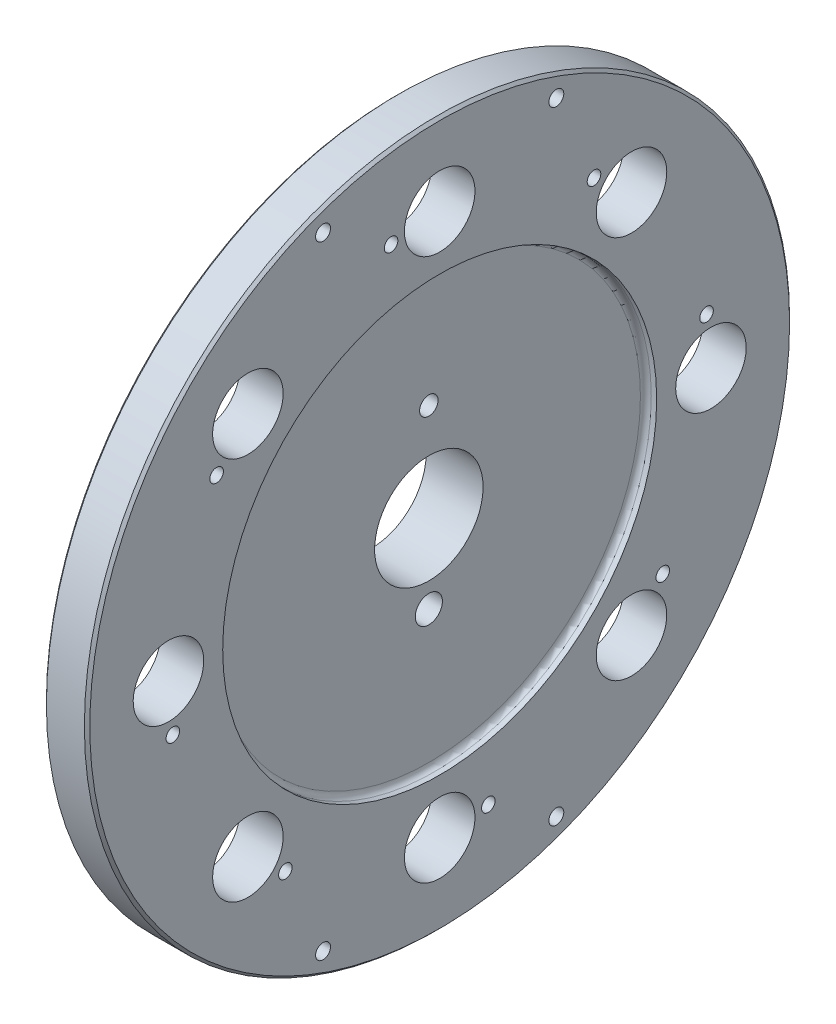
SolidWorks part; units mm, degrees
ref_plane "Płaszczyzna przednia" through (0, 0, 0) normal (0, 0, 1) x (1, 0, 0)
ref_plane "Płaszczyzna górna" through (0, 0, 0) normal (0, 1, 0) x (1, 0, 0)
ref_plane "Płaszczyzna prawa" through (0, 0, 0) normal (1, 0, 0) x (0, 0, -1)
sketch "Szkic1" plane through (0, 0, 0) normal (0, 0, 1) x (1, 0, 0)
  line L0 (0, 0) -> (-89.9458, 0) construction
  line L1 (14.9769, 130) -> (-1.0231, 130)
  line L2 (-1.0231, 130) -> (-1.0231, 60)
  line L3 (-1.0231, 60) -> (-10.0231, 60)
  line L4 (-10.0231, 60) -> (-10.0231, 20)
  line L5 (-10.0231, 20) -> (10.9769, 20)
  line L6 (14.9769, 80) -> (14.9769, 130)
  line L7 (14.9769, 80) -> (10.9769, 80)
  line L8 (10.9769, 80) -> (10.9769, 20)
  dimension "D1" = 120
  dimension "D2" = 40
  dimension "D3" = 160
  dimension "D4" = 260
  dimension "D5" = 9
  dimension "D6" = 16
  dimension "D7" = 4
revolve "Obrót1" add sketch "Szkic1" angle 360 about L0
chamfer "Sfazowanie1" distance 1 angle 45 3 edges at (-10.0231, 0, -60) (-1.0231, 0, -130) (14.9769, 0, -130)
fillet "Zaokrąglenie1" radius 1 1 edges at (-1.0231, 0, -60)
fillet "Zaokrąglenie2" radius 2 1 edges at (10.9769, 0, -80)
sketch "Szkic2" plane through (10.9769, 0, 0) normal (1, 0, 0) x (0, 0, -1)
  circle A0 centre (0, 0) radius 29 construction
  point P3 (0, -29)
  dimension "D1" = 58
hole_wizard "Otwór Ø10.0 (10)1" positions "Szkic 3D1" profile "Szkic3" hole size "Ø10.0" standard "ISO"
sketch3d "Szkic 3D1"
  point P0 (10.9769, -29, 0)
sketch "Szkic3" plane through (10.9769, -29, 0) normal (0, 1, 0) x (0, 0, -1)
  line L0 (0, 0) -> (0, 21)
  line L1 (0, 21) -> (5, 21)
  line L2 (5, 21) -> (5, 0)
  line L5 (5, 0) -> (0, 0)
  line L11 (0, -6.35) -> (0, 107.95) construction
  dimension "Średnica otworu na wylot" = 10
  dimension "Głębokość otworu na wylot" = 21
chamfer "Sfazowanie2" distance 1 angle 45 1 edges at (-10.0231, -29, -5)
sketch "Szkic4" plane through (10.9769, 0, 0) normal (1, 0, 0) x (0, 0, -1)
  circle A0 centre (0, 0) radius 36 construction
  point P3 (0, 36)
  dimension "D1" = 72
hole_wizard "Otwór gwintowany M81" positions "Szkic 3D2" profile "Szkic5" tap size "M8" standard "ISO"
sketch3d "Szkic 3D2"
  point P0 (10.9769, 36, 0)
sketch "Szkic5" plane through (10.9769, 36, 0) normal (0, 1, 0) x (0, 0, -1)
  line L0 (0, 0) -> (0, 21)
  line L1 (0, 21) -> (3.4, 21)
  line L2 (3.4, 21) -> (3.4, 0)
  line L5 (3.4, 0) -> (0, 0)
  line L11 (0, -6.35) -> (0, 107.95) construction
  dimension "Średnica otworu gwintowanego na wylot" = 6.8
  dimension "Głębokość otworu gwintowanego na wylot" = 21
sketch "Szkic6" plane through (14.9769, 0, 0) normal (1, 0, 0) x (0, 0, -1)
  circle A0 centre (0, 0) radius 100 construction
  circle A1 centre (0, -100) radius 13
  point P3 (0, -100)
  dimension "D1" = 200
  dimension "D2" = 26
extrude "Wytnij-wyciągnięcie1" cut sketch "Szkic6" against normal through all
pattern_circular "Szyk kołowy1" count 8 over 360 about axis through (0, 0, 0) along (1, 0, 0) of "Wytnij-wyciągnięcie1"
sketch "Szkic7" plane through (14.9769, 0, 0) normal (1, 0, 0) x (0, 0, -1)
  circle A0 centre (0, 0) radius 100 construction
  circle A1 centre (0, -100) radius 13 construction
  point P4 (17.927, -98.38)
  dimension "D1" = 18
hole_wizard "Otwór gwintowany M61" positions "Szkic 3D3" profile "Szkic8" tap size "M6" standard "ISO"
sketch3d "Szkic 3D3"
  point P0 (14.9769, -98.38, -17.927)
sketch "Szkic8" plane through (14.9769, -98.38, -17.927) normal (0, 1, 0) x (0, 0, -1)
  line L0 (0, 0) -> (0, 25)
  line L1 (0, 25) -> (2.5, 25)
  line L2 (2.5, 25) -> (2.5, 0)
  line L5 (2.5, 0) -> (0, 0)
  line L11 (0, -6.35) -> (0, 107.95) construction
  dimension "Średnica otworu gwintowanego na wylot" = 5
  dimension "Głębokość otworu gwintowanego na wylot" = 25
pattern_circular "Szyk kołowy2" count 8 over 360 about axis through (0, 0, 0) along (1, 0, 0) of "Otwór gwintowany M61"
sketch "Szkic9" plane through (-1.0231, 0, 0) normal (-1, 0, 0) x (0, 0, 1)
  line L0 (0, 0) -> (0, 149.5572) construction
  circle A0 centre (0, 0) radius 122.5 construction
  point P5 (-43, 114.7051)
  point P8 (43, 114.7051)
  point P9 (-43, -114.7051)
  point P11 (43, -114.7051)
  dimension "D1" = 245
  dimension "D2" = 43
  dimension "D3" = 43
  dimension "D4" = 43
  dimension "D5" = 43
hole_wizard "Pogłębienie stożkowe pod M5 Wkręt z łbem płaskim1" positions "Szkic 3D4" profile "Szkic10" countersink size "M5" standard "ISO"
sketch3d "Szkic 3D4"
  point P0 (-1.0231, 114.7051, -43)
  point P3 (-1.0231, 114.7051, 43)
  point P6 (-1.0231, -114.7051, -43)
  point P9 (-1.0231, -114.7051, 43)
sketch "Szkic10" plane through (-1.0231, 114.7051, -43) normal (0, 1, 0) x (0, 0, 1)
  line L0 (0, 0) -> (0, 16)
  line L1 (0, 16) -> (2.75, 16)
  line L2 (2.75, 16) -> (2.75, 4.45)
  line L3 (2.75, 4.45) -> (5.2, 2)
  line L4 (5.2, 2) -> (5.2, 0)
  line L6 (5.2, 0) -> (0, 0)
  line L7 (-2.75, 4.45) -> (-5.2, 2) construction
  line L11 (0, -6.35) -> (0, 107.95) construction
  dimension "Średnica otworu na wylot" = 5.5
  dimension "Głębokość otworu na wylot" = 16
  dimension "Średnica pogłębienia stożkowego." = 10.4
  dimension "Kąt pogłębienia stożkowego" = 90
  dimension "Odstęp łba" = 2
